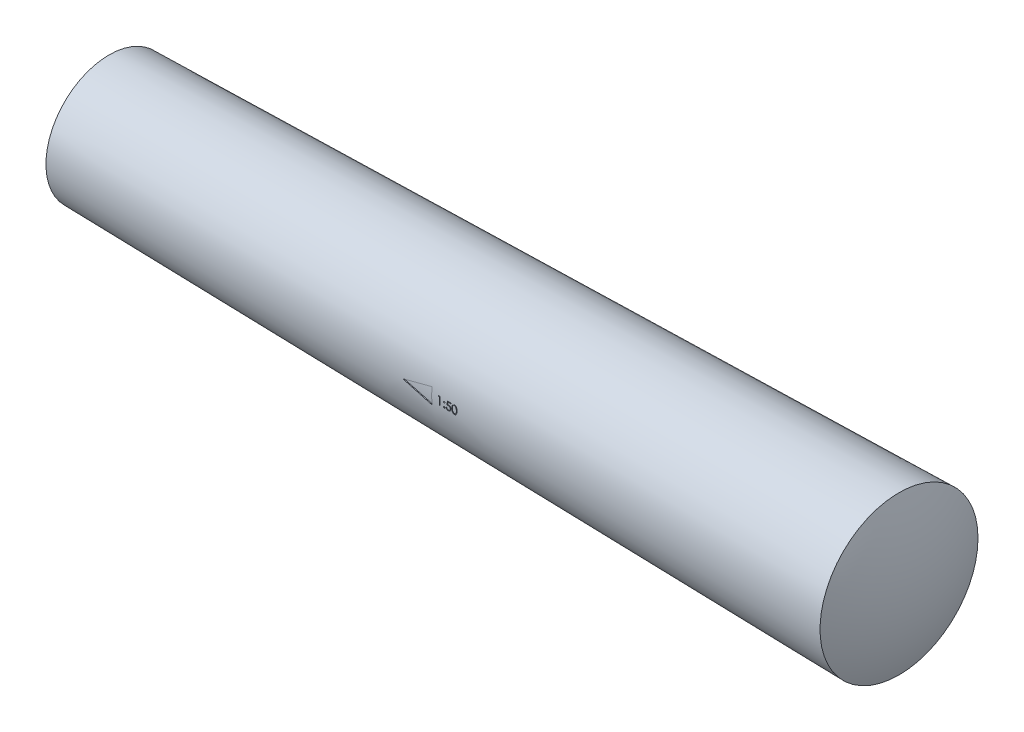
SolidWorks part; units mm, degrees
ref_plane "Front Plane" through (0, 0, 0) normal (0, 0, 1) x (1, 0, 0)
ref_plane "Top Plane" through (0, 0, 0) normal (0, 1, 0) x (1, 0, 0)
ref_plane "Right Plane" through (0, 0, 0) normal (1, 0, 0) x (0, 0, -1)
sketch "Sketch1" plane through (0, 0, 0) normal (1, 0, 0) x (0, 0, -1)
  circle A0 centre (0, 0) radius 8
  dimension "D1" = 16
extrude "Extrude1" add sketch "Sketch1" along normal mid plane 100
draft "Draft1" type of draft neutral plane draft angle 1.146 faces to draft 1 parameters "D1"=1.146
sketch "Sketch2" plane through (0, 0, 0) normal (0, 0, 1) x (1, 0, 0)
  line L0 (-50, 0) -> (-50, 8)
  line L1 (-50, 8) -> (-50, -8) construction
  line L2 (-50, 0) -> (-52, 0)
  line L3 (-52, 0) -> (-52, -9) construction
  line L4 (50, 0) -> (50, 10.0001)
  line L5 (50, -10.0001) -> (50, 10.0001) construction
  line L6 (50, 0) -> (52, 0)
  line L7 (52, 0) -> (52, -9) construction
  line L8 (-50, -8) -> (50, -10.0001) construction
  arc A0 (-52, 0) -> (-50, 8) centre (-35, 0) cw
  arc A1 (52, 0) -> (50, 10.0001) centre (25.9997, 0) ccw
  point P14 (0, -9)
revolve "Revolve1" add sketch "Sketch2" angle 360 about L2
sketch "Sketch5" plane through (0, 0, 0) normal (0, 0, 1) x (1, 0, 0)
  line L0 (0, 9) -> (0, -9) construction
  line L1 (50, 10.0001) -> (-50, 8) construction
  line L2 (-50, -8) -> (50, -10.0001) construction
ref_plane "Plane2" through (0, 0, 0) normal (-0.02, 0, 0.9998) x (0.9998, 0, 0.02)
sketch "Sketch6" plane through (0, 0, 0) normal (-0.02, 0, 0.9998) x (0.9998, 0, 0.02)
  line L0 (0, 0) -> (0, 1)
  line L1 (0, 9) -> (0, -9) construction
  line L2 (0, 1) -> (-3.7321, 0)
  line L3 (-3.7321, 0) -> (0, -1)
  line L4 (0, -1) -> (0, 0)
  line L5 (0, -0.5) -> (4, -0.5) construction
  text T0 "1:50" font "Century Gothic" height 1
  dimension "D1" = 2
  dimension "D2" = 30
  dimension "D3" = 4
wrap "Wrap2" sketch "Sketch6" wrap type deboss source sketch "Sketch6" thickness 0.1 parameters "D1"=0.1
equation "\"D2@Sketch2\" = \"D1@Sketch2\""
